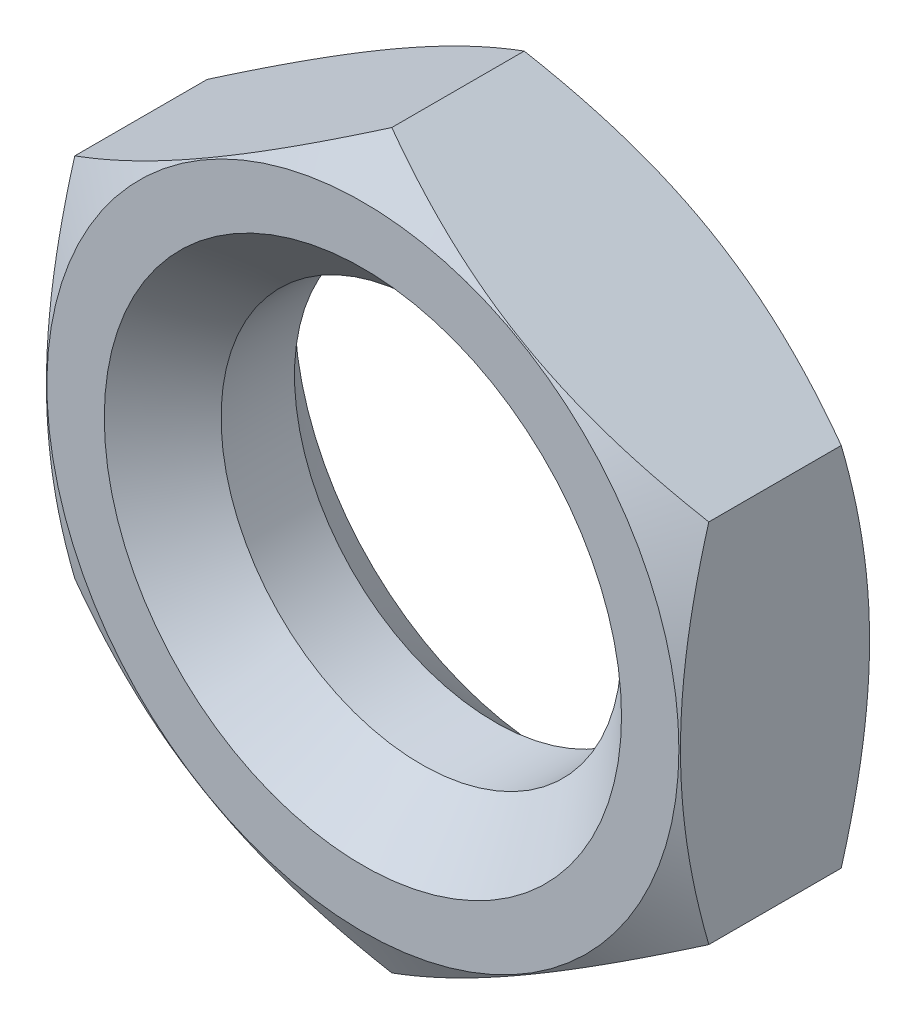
SolidWorks part; units mm, degrees
ref_plane "Front Plane" through (0, 0, 0) normal (0, 0, 1) x (1, 0, 0)
ref_plane "Top Plane" through (0, 0, 0) normal (0, 1, 0) x (1, 0, 0)
ref_plane "Right Plane" through (0, 0, 0) normal (1, 0, 0) x (0, 0, -1)
sketch "Sketch3" plane through (0, 0, 0) normal (0, 0, 1) x (1, 0, 0)
  line L1 (0, 10.9697) -> (-9.5, 5.4848)
  line L2 (-9.5, 5.4848) -> (-9.5, -5.4848)
  line L3 (-9.5, -5.4848) -> (0, -10.9697)
  line L4 (0, -10.9697) -> (9.5, -5.4848)
  line L5 (9.5, -5.4848) -> (9.5, 5.4848)
  line L6 (9.5, 5.4848) -> (0, 10.9697)
  circle A0 centre (0, 0) radius 9.5 construction
  dimension "D1" = 19
extrude "Boss-Extrude1" add sketch "Sketch3" along normal mid plane 5.7
sketch "Sketch4" plane through (0, 0, 0) normal (1, 0, 0) x (0, 0, -1)
  line L0 (-5.4578, 0) -> (6.1545, 0) construction
sketch "Sketch5" plane through (0, 0, 0) normal (1, 0, 0) x (0, 0, -1)
  line L0 (-2.85, 10.9697) -> (-2.85, 9.4697)
  line L1 (-2.85, 5.4848) -> (-2.85, 10.9697) construction
  line L2 (-2.85, 9.4697) -> (-1.984, 10.9697)
  line L3 (-2.85, 10.9697) -> (2.85, 10.9697) construction
  line L4 (-1.984, 10.9697) -> (-2.85, 10.9697)
  dimension "D1" = 1.5
  dimension "D2" = 30
revolve "Cut-Revolve1" cut sketch "Sketch5" angle 360 about L0
mirror "Mirror1" about plane through (0, 0, 0) normal (0, 0, 1) of "Cut-Revolve1"
sketch "Sketch6" plane through (0, 0, 2.85) normal (0, 0, 1) x (1, 0, 0)
  circle A0 centre (0, 0) radius 6
  dimension "D1" = 12
extrude "Cut-Extrude1" cut sketch "Sketch6" against normal blind 5.7
chamfer "Chamfer1" distance 1.75 angle 45 2 edges at (6, 0, -2.85) (6, 0, 2.85)
